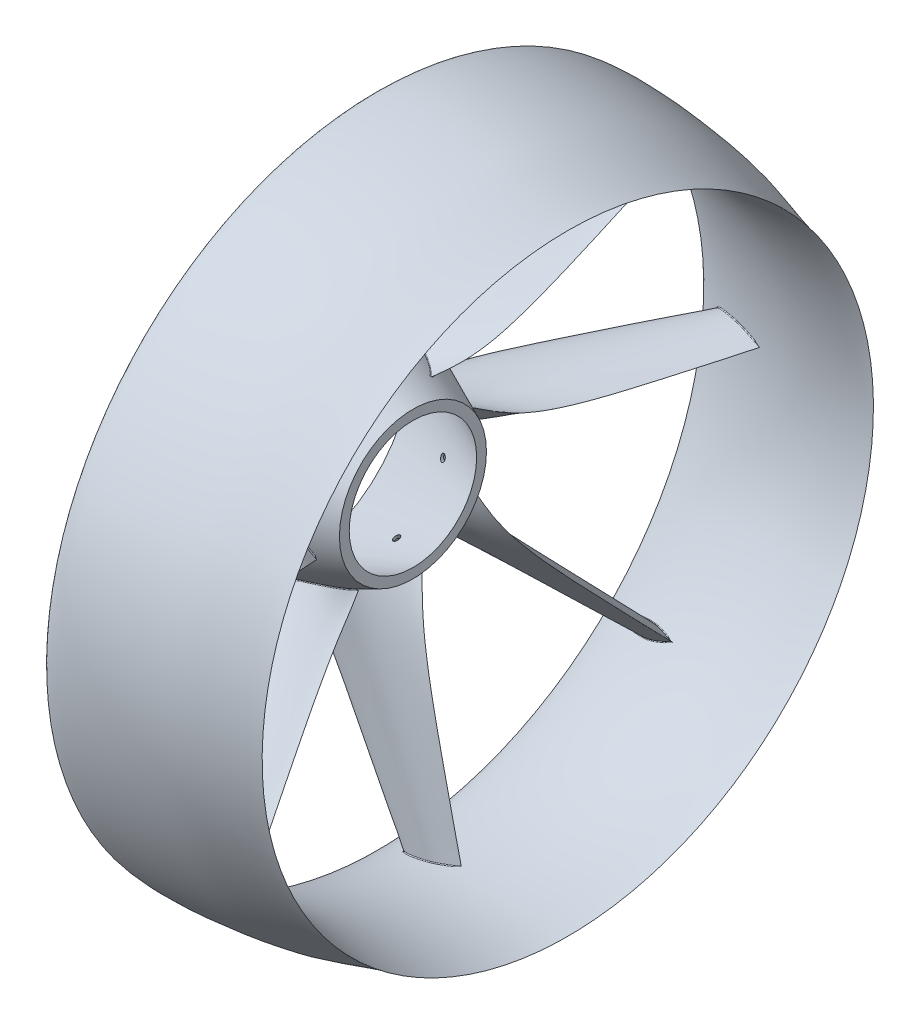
SolidWorks part; units mm, degrees
ref_plane "Plane1" through (0, 0, 0) normal (0, 0, 1) x (1, 0, 0)
ref_plane "Plane2" through (0, 0, 0) normal (0, 1, 0) x (1, 0, 0)
ref_plane "Plane3" through (0, 0, 0) normal (1, 0, 0) x (0, 0, -1)
sketch "Sketch1" plane through (0, 0, 0) normal (1, 0, 0) x (0, 0, -1)
  circle A0 centre (0, 0) radius 47.625
  dimension "D1" = 95.25
extrude "Base-Extrude" add sketch "Sketch1" against normal blind 76.2 draft 24
curve "Curve1"
curve "Curve2"
curve "Curve3"
curve "Curve4"
curve "Curve5"
curve "Curve6"
curve "Curve7"
curve "Curve8"
curve "Curve9"
curve "Curve10"
curve "Curve11"
loft "Boss-Loft1" add
fillet "Fillet3" radius 0.508
draft "Draft1" type of draft neutral plane draft angle 17 neutral plane "Plane3" faces to draft 1 parameters "D1"=17
pattern_circular "CirPattern1" count 8 every 45
curve "Curve12"
sketch "Sketch2" plane through (0, 0, 0) normal (0, 0, 1) x (1, 0, 0)
  line L0 (0, 0) -> (89.0561, 0) construction
  line L1 (-76.2, 0) -> (0, 0) construction
  point P5 (100.306, 197.9824)
  dimension "D1" = 0
revolve "Boss-Revolve1" add sketch "Sketch2" angle 360 about L0
sketch "Sketch3" plane through (0, 0, 0) normal (1, 0, 0) x (0, 0, -1)
  circle A2 centre (0, 0) radius 41.275
  circle A3 centre (0, 0) radius 41.275
  dimension "D1" = 6.35
extrude "Cut-Extrude1" cut sketch "Sketch3" against normal through all draft 24
ref_plane "Plane5" through (0, 0, 0) normal (0, -0.3827, 0.9239) x (1, 0, 0)
sketch "Sketch4" plane through (0, 0, 0) normal (0, -0.3827, 0.9239) x (1, 0, 0)
  line L0 (-76.2, 81.5514) -> (-76.2, -81.5514) construction
  circle A0 centre (-31.75, 0) radius 2.1844
  dimension "D2" = 4.3688
  dimension "D1" = 44.45
extrude "Cut-Extrude2" cut sketch "Sketch4" against normal through all
pattern_circular "CirPattern2" count 8 every 45
fillet "Fillet8" radius 0.508
ref_plane "Plane6" through (0, -29.1605, 70.3996) normal (0, -0.3827, 0.9239) x (1, 0, 0)
sketch "Sketch5" plane through (0, -29.1605, 70.3996) normal (0, -0.3827, 0.9239) x (1, 0, 0)
  line L0 (-76.2, 0) -> (0, 0) construction
  circle A0 centre (-31.75, 0) radius 3.9688
  circle A1 centre (-31.75, 0) radius 2.1844 construction
  dimension "D1" = 7.9375
extrude "Cut-Extrude3" cut sketch "Sketch5" against normal blind 17.78
pattern_circular "CirPattern3" count 8 every 45
ref_plane "CSHolePl" [suppressed] through (-38.1, 59.6717, 24.7168) normal (0.4067, 0.844, 0.3496) x (0, -0.3827, 0.9239)
sketch "Sketch10" [suppressed] plane through (0, 0, 0) normal (0, -0.3827, 0.9239) x (1, 0, 0)
  line L0 (0, 47.625) -> (-76.2, 81.5514) construction
  line L1 (-31.75, 61.761) -> (-36.5184, 63.8841)
  line L2 (-31.75, 61.761) -> (-53.9431, 11.9145) construction
  line L3 (-76.2, 81.5514) -> (-76.2, -81.5514) construction
  line L4 (-36.5184, 63.8841) -> (-35.4459, 60.3759)
  line L5 (-35.4459, 60.3759) -> (-44.6509, 39.7011)
  line L6 (-44.6509, 39.7011) -> (-42.0811, 38.557)
  line L7 (-42.0811, 38.557) -> (-31.75, 61.761)
  dimension "D1" = 40.0825
  dimension "D2" = 10.4394
  dimension "D3" = 41
  dimension "D4" = 2.7686
  dimension "D5" = 5.626
  dimension "D6" = 25.4
revolve "Cut-Revolve1" [suppressed] cut sketch "Sketch10" angle 360 about L2
pattern_circular "CirPattern4" [suppressed] count 8 over 360
sketch "Sketch11" [suppressed] plane through (0, 0, 0) normal (0, 0, 1) x (1, 0, 0)
  line L0 (100.306, 197.9824) -> (100.306, 234.2656)
  point P0 (100.306, 197.9824)
